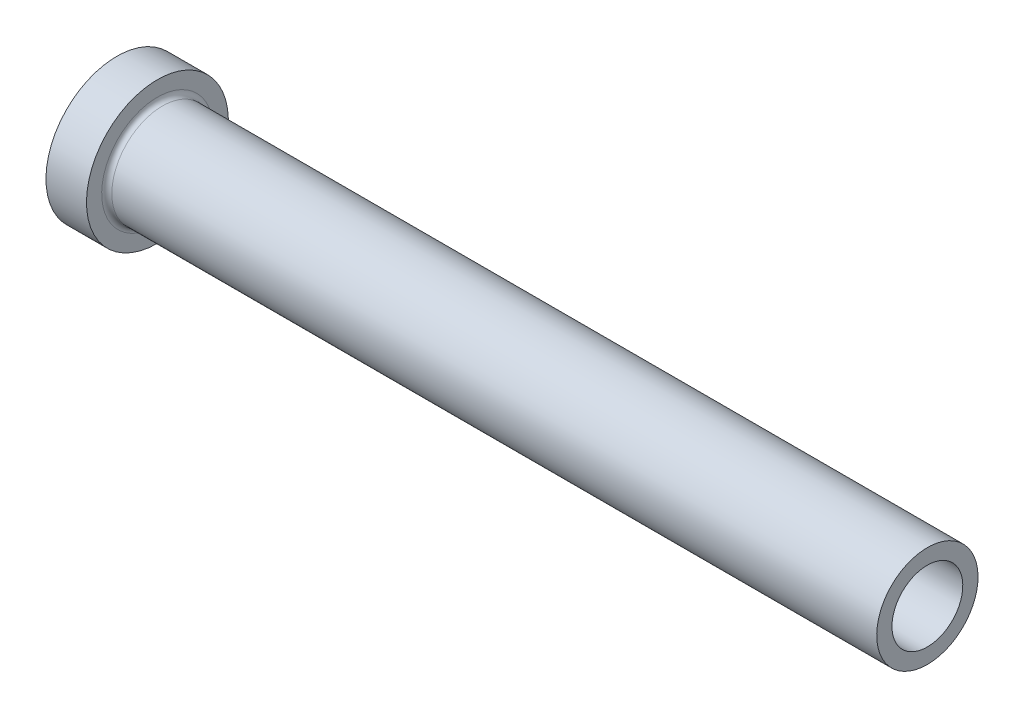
SolidWorks part; units mm, degrees
ref_plane "Front Plane" through (0, 0, 0) normal (0, 0, 1) x (1, 0, 0)
ref_plane "Top Plane" through (0, 0, 0) normal (0, 1, 0) x (1, 0, 0)
ref_plane "Right Plane" through (0, 0, 0) normal (1, 0, 0) x (0, 0, -1)
sketch "Sketch1" plane through (0, 0, 0) normal (0, 0, 1) x (1, 0, 0)
  line L0 (127, -4.3586) -> (50.8, -4.3586) construction
  line L1 (0, 6.7539) -> (0, 2.5803)
  line L2 (0, 2.5803) -> (1.1906, 1.3897)
  line L3 (1.1906, 1.3897) -> (69.1094, 1.3897)
  line L4 (69.1094, 1.3897) -> (69.85, 1.1913)
  line L5 (69.85, 1.1913) -> (127, 1.1913)
  line L6 (127, 1.1913) -> (127, 3.5789)
  line L7 (127, 3.5789) -> (7.1437, 3.5789)
  line L8 (6.35, 4.3726) -> (6.35, 6.7539)
  line L9 (6.35, 6.7539) -> (0, 6.7539)
  arc A0 (7.1437, 3.5789) -> (6.35, 4.3726) centre (7.1437, 4.3726) cw
  dimension "D4" = 0.7938
  dimension "D1" = 1.1906
  dimension "HeadThickness" = 6.35
  dimension "HeadDia" = 22.225
  dimension "OverallLength" = 127
  dimension "ID" = 11.0998
  dimension "OD" = 15.875
  dimension "BearingSurf" = 57.15
  dimension "D2" = 15
  dimension "D3" = 0.1984
  dimension "D5" = 45
revolve "Revolve1" add sketch "Sketch1" angle 360 about L0
